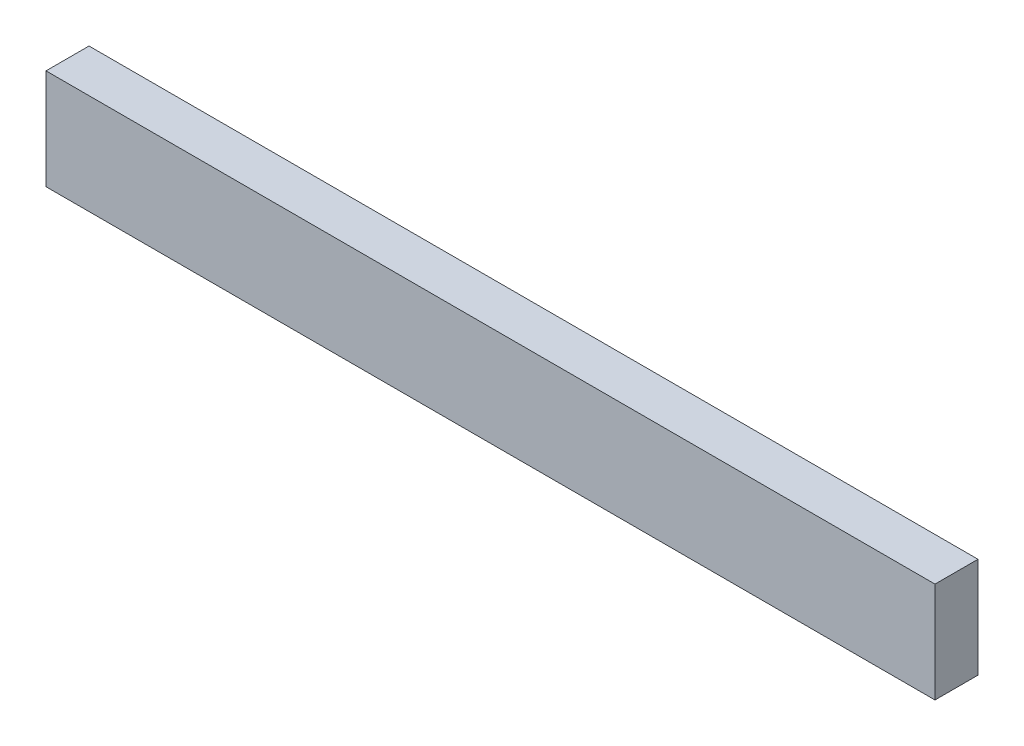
SolidWorks part; units mm, degrees
ref_plane "Front Plane" through (0, 0, 0) normal (0, 0, 1) x (1, 0, 0)
ref_plane "Top Plane" through (0, 0, 0) normal (0, 1, 0) x (1, 0, 0)
ref_plane "Right Plane" through (0, 0, 0) normal (1, 0, 0) x (0, 0, -1)
sketch "Sketch1" plane through (0, 0, 0) normal (1, 0, 0) x (0, 0, -1)
  line L1 (-19.05, -44.45) -> (19.05, -44.45)
  line L2 (-19.05, -44.45) -> (-19.05, 44.45)
  line L3 (-19.05, 44.45) -> (19.05, 44.45)
  line L4 (19.05, -44.45) -> (19.05, 44.45)
  line L5 (-19.05, -44.45) -> (19.05, 44.45) construction
  line L6 (-19.05, 44.45) -> (19.05, -44.45) construction
  point P0 (0, 0)
  dimension "D1" = 88.9
  dimension "D2" = 38.1
extrude "Boss-Extrude1" add sketch "Sketch1" along normal blind 787.4
